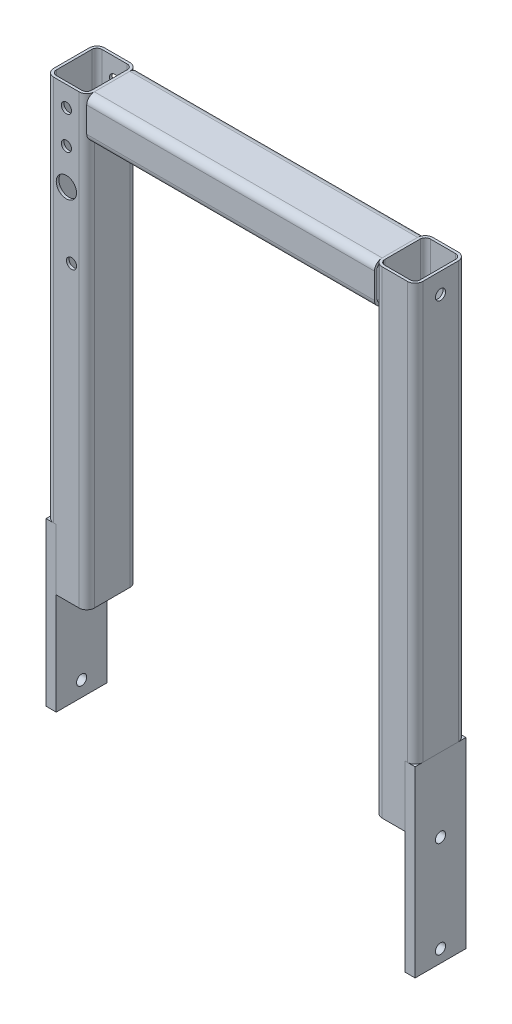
SolidWorks part; units mm, degrees
ref_plane "Front Plane" through (0, 0, 0) normal (0, 0, 1) x (1, 0, 0)
ref_plane "Top Plane" through (0, 0, 0) normal (0, 1, 0) x (1, 0, 0)
ref_plane "Right Plane" through (0, 0, 0) normal (1, 0, 0) x (0, 0, -1)
sketch "Sketch1" plane through (0, 0, 0) normal (0, 0, 1) x (1, 0, 0)
  line L0 (-94.742, 0) -> (-94.742, 254)
  line L1 (-94.742, 254) -> (85.09, 254)
  line L2 (85.09, 254) -> (85.09, -19.05)
  line L3 (85.09, -19.05) -> (110.49, -19.05)
  line L4 (110.49, -19.05) -> (110.49, 279.4)
  line L5 (110.49, 279.4) -> (85.09, 279.4)
  line L6 (85.09, 279.4) -> (-94.742, 279.4)
  line L7 (-94.742, 279.4) -> (-120.142, 279.4)
  line L8 (-120.142, 279.4) -> (-120.142, 0)
  line L9 (-120.142, 0) -> (-94.742, 0)
  line L10 (0, 0) -> (0, 41.4877) construction
  line L11 (-94.742, 254) -> (-94.742, 279.4)
  line L12 (85.09, 254) -> (85.09, 279.4)
  line L13 (-113.792, 0) -> (-113.792, 38.1)
  line L14 (-113.792, 38.1) -> (-120.142, 38.1)
  line L15 (110.49, 19.05) -> (104.14, 19.05)
  line L17 (-113.792, 0) -> (-113.792, -63.5)
  line L18 (-113.792, -63.5) -> (-120.142, -63.5)
  line L19 (-120.142, -63.5) -> (-120.142, 0)
  line L20 (104.14, 19.05) -> (104.14, -95.25)
  line L21 (104.14, -95.25) -> (110.49, -95.25)
  line L22 (110.49, -95.25) -> (110.49, -19.05)
  circle A0 centre (-107.442, 223.8248) radius 3.175
  circle A1 centre (-107.442, 223.8248) radius 6.35
  circle A2 centre (-104.267, 184.15) radius 3.175
  circle A3 centre (-107.442, 266.7) radius 3.175
  circle A4 centre (-107.442, 246.0498) radius 3.175
  dimension "D16" = 6.35
  dimension "D17" = 12.7
  dimension "D20" = 6.35
  dimension "D22" = 6.35
  dimension "D1" = 94.742
  dimension "D2" = 25.4
  dimension "D3" = 25.4
  dimension "D4" = 279.4
  dimension "D5" = 6.35
  dimension "D6" = 38.1
  dimension "D7" = 85.09
  dimension "D8" = 38.1
  dimension "D9" = 63.5
  dimension "D10" = 19.05
  dimension "D11" = 6.35
  dimension "D12" = 25.4
  dimension "D13" = 114.3
  dimension "D14" = 12.7
  dimension "D15" = 55.5752
  dimension "D18" = 9.525
  dimension "D19" = 95.25
  dimension "D21" = 12.7
  dimension "D23" = 22.225
sketch "Sketch2" plane through (0, 0, 0) normal (0, 0, 1) x (1, 0, 0)
  line L0 (-94.742, 254) -> (85.09, 254) construction
  line L1 (85.09, 254) -> (85.09, 279.4) construction
  line L2 (85.09, 279.4) -> (-94.742, 279.4) construction
  line L3 (-94.742, 254) -> (-94.742, 279.4) construction
  line L4 (-94.742, 254) -> (85.09, 254)
  line L5 (85.09, 254) -> (85.09, 279.4)
  line L6 (85.09, 279.4) -> (-94.742, 279.4)
  line L7 (-94.742, 254) -> (-94.742, 279.4)
extrude "Boss-Extrude1" add sketch "Sketch2" along normal mid plane 31.75
fillet "Fillet1" radius 4.7752 4 edges at (-4.826, 254, -15.875) (-4.826, 254, 15.875) (-4.826, 279.4, -15.875) (-4.826, 279.4, 15.875)
shell "Shell1" thickness 1.651
sketch "Sketch3" plane through (0, 0, 0) normal (0, 0, 1) x (1, 0, 0)
  line L0 (-120.142, 0) -> (-94.742, 0) construction
  line L1 (-94.742, 0) -> (-94.742, 254) construction
  line L2 (-94.742, 254) -> (-94.742, 279.4) construction
  line L3 (-94.742, 279.4) -> (-120.142, 279.4) construction
  line L4 (-120.142, 279.4) -> (-120.142, 0) construction
  line L5 (110.49, 279.4) -> (85.09, 279.4) construction
  line L6 (85.09, 254) -> (85.09, 279.4) construction
  line L7 (110.49, -19.05) -> (110.49, 279.4) construction
  line L8 (85.09, 254) -> (85.09, -19.05) construction
  line L9 (85.09, -19.05) -> (110.49, -19.05) construction
  line L10 (-120.142, 0) -> (-94.742, 0)
  line L11 (-94.742, 0) -> (-94.742, 254)
  line L12 (-94.742, 254) -> (-94.742, 279.4)
  line L13 (-94.742, 279.4) -> (-120.142, 279.4)
  line L14 (-120.142, 279.4) -> (-120.142, 0)
  line L15 (110.49, 279.4) -> (85.09, 279.4)
  line L16 (85.09, 254) -> (85.09, 279.4)
  line L17 (110.49, -19.05) -> (110.49, 279.4)
  line L18 (85.09, 254) -> (85.09, -19.05)
  line L19 (85.09, -19.05) -> (110.49, -19.05)
extrude "Boss-Extrude2" add sketch "Sketch3" along normal mid plane 31.75 separate body
fillet "Fillet2" radius 4.7752 4 edges at (-94.742, 139.7, -15.875) (-120.142, 139.7, -15.875) (-120.142, 139.7, 15.875) (-94.742, 139.7, 15.875)
fillet "Fillet3" radius 4.7752 4 edges at (110.49, 130.175, -15.875) (85.09, 130.175, -15.875) (85.09, 130.175, 15.875) (110.49, 130.175, 15.875)
shell "Shell3" thickness 1.651
shell "Shell4" thickness 1.651
sketch "Sketch4" plane through (0, 0, 0) normal (0, 0, 1) x (1, 0, 0)
  line L0 (-113.792, 0) -> (-113.792, 38.1) construction
  line L1 (-120.142, 0) -> (-94.742, 0) construction
  line L2 (-120.142, 279.4) -> (-120.142, 0) construction
  line L3 (-113.792, 0) -> (-113.792, 38.1)
  line L4 (-120.142, 0) -> (-113.792, 0)
  line L5 (-120.142, 38.1) -> (-120.142, 0)
  line L6 (-113.792, 38.1) -> (-120.142, 38.1) construction
  line L7 (-113.792, 38.1) -> (-120.142, 38.1)
  line L10 (110.49, -19.05) -> (110.49, 279.4) construction
  line L11 (110.49, 19.05) -> (104.14, 19.05) construction
  line L12 (104.14, 19.05) -> (104.14, -95.25) construction
  line L13 (110.49, -95.25) -> (110.49, -19.05) construction
  line L14 (110.49, -19.05) -> (110.49, 19.05)
  line L15 (110.49, 19.05) -> (104.14, 19.05)
  line L16 (104.14, -95.25) -> (110.49, -95.25) construction
  line L17 (104.14, 19.05) -> (104.14, -95.25)
  line L18 (110.49, -95.25) -> (110.49, -19.05)
  line L19 (104.14, -95.25) -> (110.49, -95.25)
extrude "Cut-Extrude1" cut sketch "Sketch4" against normal mid plane 50.8
sketch "Sketch5" plane through (0, 0, 0) normal (0, 0, 1) x (1, 0, 0)
  line L0 (-113.792, -63.5) -> (-120.142, -63.5) construction
  line L1 (-113.792, 0) -> (-113.792, -63.5) construction
  line L2 (-113.792, 0) -> (-113.792, 38.1) construction
  line L3 (-113.792, 38.1) -> (-120.142, 38.1) construction
  line L4 (-120.142, 279.4) -> (-120.142, 0) construction
  line L5 (-120.142, -63.5) -> (-120.142, 0) construction
  line L8 (110.49, -95.25) -> (110.49, -19.05) construction
  line L9 (110.49, 19.05) -> (104.14, 19.05) construction
  line L11 (110.49, -19.05) -> (110.49, 279.4) construction
  line L12 (-113.792, -63.5) -> (-120.142, -63.5)
  line L13 (-113.792, 0) -> (-113.792, -63.5)
  line L14 (-113.792, 0) -> (-113.792, 38.1)
  line L15 (-113.792, 38.1) -> (-120.142, 38.1)
  line L16 (-120.142, 38.1) -> (-120.142, 0)
  line L17 (-120.142, -63.5) -> (-120.142, 0)
  line L18 (104.14, 19.05) -> (104.14, -95.25) construction
  line L19 (104.14, 19.05) -> (104.14, -95.25)
  line L20 (110.49, -95.25) -> (110.49, -19.05)
  line L21 (110.49, 19.05) -> (104.14, 19.05)
  line L22 (104.14, -95.25) -> (110.49, -95.25) construction
  line L23 (110.49, -19.05) -> (110.49, 19.05)
  line L24 (104.14, -95.25) -> (110.49, -95.25)
extrude "Boss-Extrude3" add sketch "Sketch5" along normal mid plane 31.75 separate body
sketch "Sketch6" plane through (0, 0, 0) normal (1, 0, 0) x (0, 0, -1)
  line L0 (-15.875, -95.25) -> (15.875, -95.25) construction
  circle A0 centre (0, -87.3252) radius 3.175
  circle A1 centre (0, -27.0002) radius 3.175
  dimension "D3" = 6.35
  dimension "D1" = 60.325
  dimension "D2" = 7.9248
extrude "Cut-Extrude2" cut sketch "Sketch6" along normal blind 152.4
sketch "Sketch7" plane through (0, 0, 0) normal (1, 0, 0) x (0, 0, -1)
  line L0 (-15.875, -63.5) -> (15.875, -63.5) construction
  circle A0 centre (0, -9.525) radius 3.175
  circle A1 centre (0, -53.975) radius 3.175
  dimension "D1" = 6.35
  dimension "D2" = 9.525
  dimension "D3" = 44.45
extrude "Cut-Extrude3" cut sketch "Sketch7" against normal blind 152.4
sketch "Sketch8" plane through (0, 0, 0) normal (0, 0, 1) x (1, 0, 0)
  circle A0 centre (-107.442, 223.8248) radius 3.175 construction
  circle A1 centre (-107.442, 223.8248) radius 3.175
extrude "Cut-Extrude4" cut sketch "Sketch8" against normal blind 30.48
sketch "Sketch9" plane through (0, 0, 0) normal (0, 0, 1) x (1, 0, 0)
  circle A0 centre (-107.442, 223.8248) radius 6.35 construction
  circle A1 centre (-107.442, 223.8248) radius 6.35
extrude "Cut-Extrude6" cut sketch "Sketch9" along normal blind 30.48
sketch "Sketch10" plane through (0, 0, 0) normal (0, 0, 1) x (1, 0, 0)
  circle A0 centre (-104.267, 184.15) radius 3.175 construction
  circle A1 centre (-104.267, 184.15) radius 3.175
  circle A2 centre (-107.442, 266.7) radius 3.175 construction
  circle A3 centre (-107.442, 266.7) radius 3.175
  circle A4 centre (-107.442, 246.0498) radius 3.175 construction
  circle A5 centre (-107.442, 246.0498) radius 3.175
extrude "Cut-Extrude7" cut sketch "Sketch10" against normal mid plane 45.72
sketch "Sketch11" plane through (0, 0, 0) normal (1, 0, 0) x (0, 0, -1)
  line L0 (-11.0998, 279.4) -> (11.0998, 279.4) construction
  circle A0 centre (0, 266.7) radius 3.175
  dimension "D2" = 6.35
  dimension "D1" = 12.7
extrude "Cut-Extrude8" cut sketch "Sketch11" along normal blind 20.32 from offset 99.06
